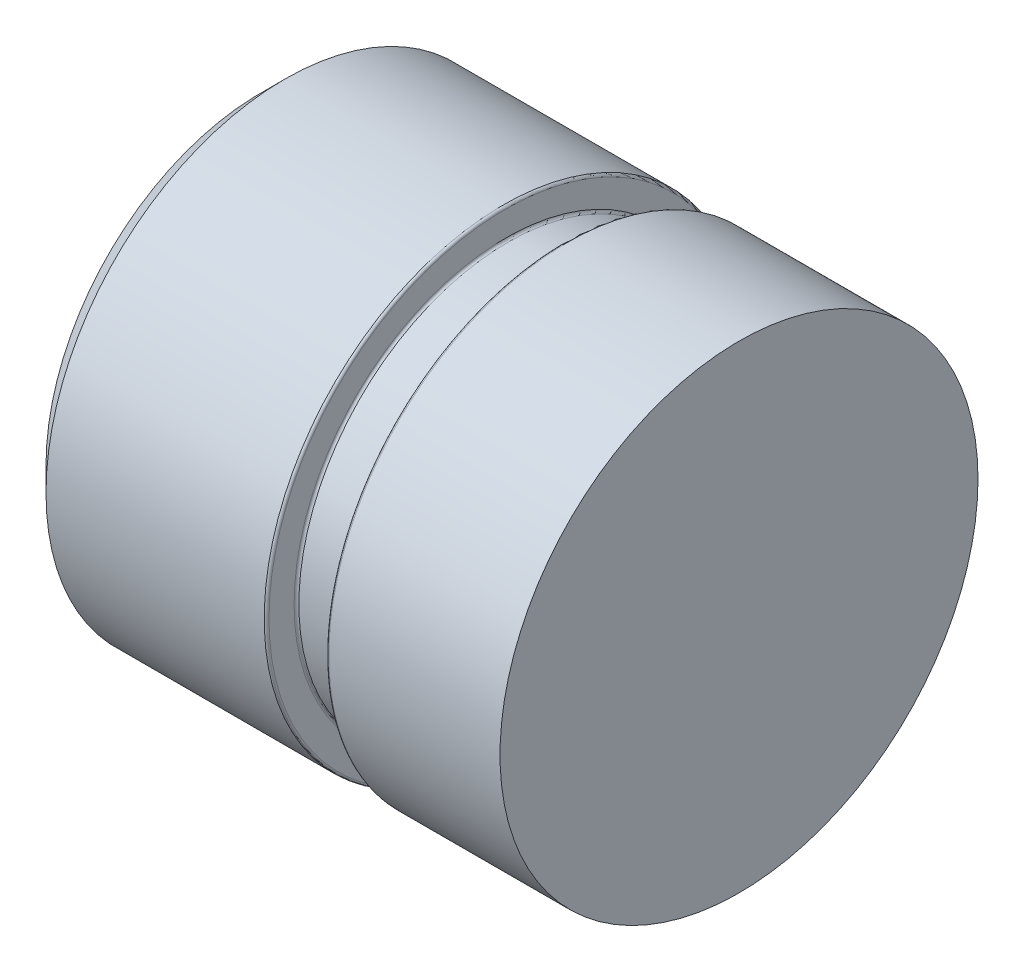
SolidWorks part; units mm, degrees
ref_plane "Front Plane" through (0, 0, 0) normal (0, 0, 1) x (1, 0, 0)
ref_plane "Top Plane" through (0, 0, 0) normal (0, 1, 0) x (1, 0, 0)
ref_plane "Right Plane" through (0, 0, 0) normal (1, 0, 0) x (0, 0, -1)
sketch "Sketch1" plane through (0, 0, 0) normal (0, 0, 1) x (1, 0, 0)
  line L0 (0, 0) -> (0, 25.4)
  line L1 (0, 25.4) -> (-18.2035, 25.4)
  line L2 (-18.4575, 25.146) -> (-18.4575, 22.479)
  line L3 (-18.7115, 22.225) -> (-24.5535, 22.225)
  line L4 (-24.8075, 22.479) -> (-24.8075, 25.146)
  line L5 (-25.0615, 25.4) -> (-50.794, 25.4)
  line L6 (-50.794, 25.4) -> (-50.794, 0)
  line L7 (-50.794, 0) -> (-0.8585, 0)
  line L8 (15.8821, 0) -> (-75.5471, 0) construction
  line L9 (0, 0) -> (-0.8585, 0)
  arc A0 (-18.2035, 25.4) -> (-18.4575, 25.146) centre (-18.2035, 25.146) ccw
  arc A1 (-18.4575, 22.479) -> (-18.7115, 22.225) centre (-18.7115, 22.479) cw
  arc A2 (-24.5535, 22.225) -> (-24.8075, 22.479) centre (-24.5535, 22.479) cw
  arc A3 (-24.8075, 25.146) -> (-25.0615, 25.4) centre (-25.0615, 25.146) ccw
  point P14 (-18.4575, 25.4)
  point P17 (-18.4575, 22.225)
  point P20 (-24.8075, 22.225)
  dimension "D5" = 0.254
  dimension "D1" = 25.4
  dimension "D2" = 25.4
  dimension "D3" = 3.175
  dimension "D4" = 6.35
revolve "Revolve1" add sketch "Sketch1" angle 360 about L8
chamfer "Chamfer1" distance 2.54 angle 45 1 edges at (-50.794, 0, -25.4)
